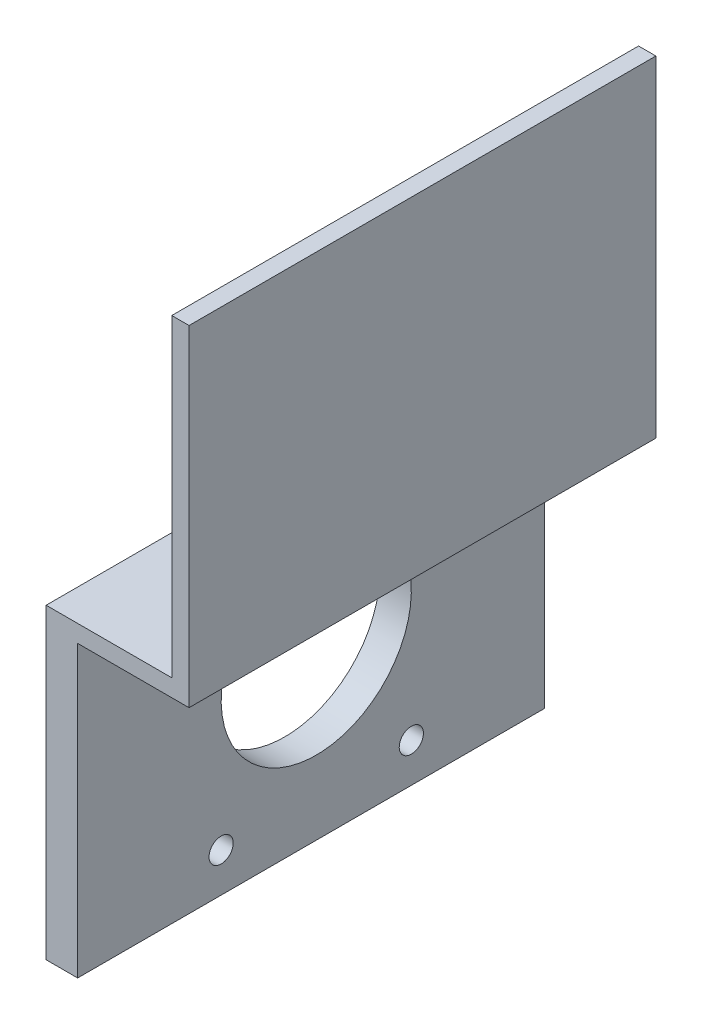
SolidWorks part; units mm, degrees
ref_plane "Plan de face" through (0, 0, 0) normal (0, 0, 1) x (1, 0, 0)
ref_plane "Plan de dessus" through (0, 0, 0) normal (0, 1, 0) x (1, 0, 0)
ref_plane "Plan de droite" through (0, 0, 0) normal (1, 0, 0) x (0, 0, -1)
sketch "Esquisse1" plane through (0, 0, 0) normal (0, 0, 1) x (1, 0, 0)
  line L0 (27.3336, 182.3235) -> (27.3336, 4.7054)
  line L2 (27.3336, 182.3235) -> (99.9957, 182.3235)
  line L3 (27.3336, 4.7054) -> (45.558, 4.7054)
  line L4 (99.9957, 182.3235) -> (99.9957, 363.7682)
  line L5 (99.9957, 363.7682) -> (109.9957, 363.7682)
  line L6 (109.9957, 363.7682) -> (109.9957, 172.3235)
  line L7 (109.9957, 172.3235) -> (45.558, 172.3235)
  line L8 (45.558, 172.3235) -> (45.558, 4.7054)
  dimension "D1" = 10
  dimension "D2" = 10
extrude "Extrusion1" add sketch "Esquisse1" along normal blind 60 and the other way blind 210
sketch "Esquisse2" plane through (45.558, 0, 0) normal (1, 0, 0) x (0, 0, -1)
  line L3 (-60, 172.3235) -> (210, 172.3235) construction
  circle A0 centre (78, 102.3235) radius 55
  circle A1 centre (133, 152.3235) radius 7
  circle A2 centre (23, 152.3235) radius 7
  circle A3 centre (23, 27.3235) radius 7
  circle A4 centre (133, 27.3235) radius 7
  dimension "D1" = 110
  dimension "D2" = 70
  dimension "D3" = 14
  dimension "D4" = 14
  dimension "D5" = 14
  dimension "D6" = 14
  dimension "D7" = 110
  dimension "D8" = 55
  dimension "D9" = 50
  dimension "D10" = 50
  dimension "D11" = 110
  dimension "D12" = 55
  dimension "D13" = 125
extrude "Enlèv. mat.-Extru.1" cut sketch "Esquisse2" against normal through all
ref_plane "Plan1" through (0, 102.3235, 0) normal (0, -1, 0) x (1, 0, 0)
